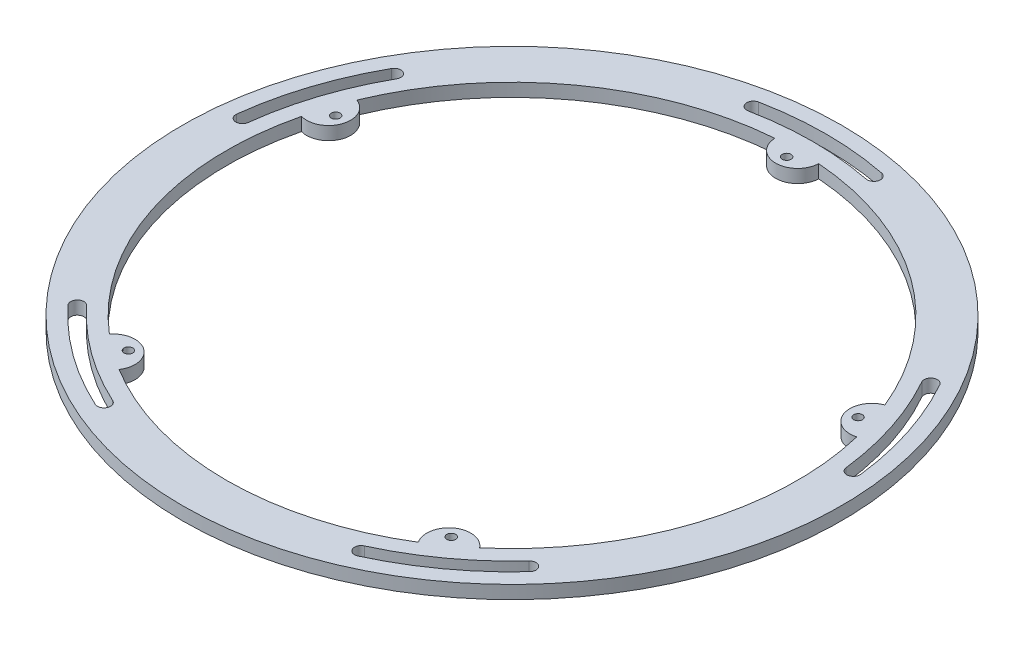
SolidWorks part; units mm, degrees
ref_plane "Plan de face" through (0, 0, 0) normal (0, 0, 1) x (1, 0, 0)
ref_plane "Plan de dessus" through (0, 0, 0) normal (0, 1, 0) x (1, 0, 0)
ref_plane "Plan de droite" through (0, 0, 0) normal (1, 0, 0) x (0, 0, -1)
sketch "Esquisse1" plane through (0, 0, 0) normal (0, 1, 0) x (1, 0, 0)
  line L0 (0, 65) -> (0, 75) construction
  line L1 (0, 65) -> (0, 60) construction
  line L2 (-66.574, 21.6312) -> (0, 0) construction
  circle A0 centre (0, 0) radius 75
  circle A1 centre (0, 0) radius 65 construction
  arc A2 (13.7063, 68.645) -> (-13.7063, 68.645) centre (0, 0) ccw construction
  arc A3 (14, 70.116) -> (-14, 70.116) centre (0, 0) ccw
  arc A4 (13.4126, 67.174) -> (-13.4126, 67.174) centre (0, 0) ccw
  arc A5 (13.4126, 67.174) -> (14, 70.116) centre (13.7063, 68.645) ccw
  arc A6 (-14, 70.116) -> (-13.4126, 67.174) centre (-13.7063, 68.645) ccw
  arc A7 (69.5208, 8.177) -> (61.0498, 34.2479) centre (0, 0) ccw construction
  arc A8 (71.0105, 8.3522) -> (62.358, 34.9818) centre (0, 0) ccw
  arc A9 (68.031, 8.0018) -> (59.7416, 33.5141) centre (0, 0) ccw
  arc A10 (68.031, 8.0018) -> (71.0105, 8.3522) centre (69.5208, 8.177) ccw
  arc A11 (62.358, 34.9818) -> (59.7416, 33.5141) centre (61.0498, 34.2479) ccw
  arc A12 (29.2599, -63.5913) -> (51.4371, -47.4786) centre (0, 0) ccw construction
  arc A13 (29.8869, -64.954) -> (52.5394, -48.496) centre (0, 0) ccw
  arc A14 (28.6329, -62.2287) -> (50.3349, -46.4612) centre (0, 0) ccw
  arc A15 (28.6329, -62.2287) -> (29.8869, -64.954) centre (29.2599, -63.5913) ccw
  arc A16 (52.5394, -48.496) -> (50.3349, -46.4612) centre (51.4371, -47.4786) ccw
  arc A17 (-51.4371, -47.4786) -> (-29.2599, -63.5913) centre (0, 0) ccw construction
  arc A18 (-52.5394, -48.496) -> (-29.8869, -64.954) centre (0, 0) ccw
  arc A19 (-50.3349, -46.4612) -> (-28.6329, -62.2287) centre (0, 0) ccw
  arc A20 (-50.3349, -46.4612) -> (-52.5394, -48.496) centre (-51.4371, -47.4786) ccw
  arc A21 (-29.8869, -64.954) -> (-28.6329, -62.2287) centre (-29.2599, -63.5913) ccw
  arc A22 (-61.0498, 34.2479) -> (-69.5208, 8.177) centre (0, 0) ccw construction
  arc A23 (-62.358, 34.9818) -> (-71.0105, 8.3522) centre (0, 0) ccw
  arc A24 (-59.7416, 33.5141) -> (-68.031, 8.0018) centre (0, 0) ccw
  arc A25 (-59.7416, 33.5141) -> (-62.358, 34.9818) centre (-61.0498, 34.2479) ccw
  arc A26 (-71.0105, 8.3522) -> (-68.031, 8.0018) centre (-69.5208, 8.177) ccw
  arc A27 (4.9963, 64.8077) -> (-4.9963, 64.8077) centre (0, 65) cw
  circle A28 centre (0, 62.5) radius 1
  arc A29 (63.1797, 15.2749) -> (60.0918, 24.7784) centre (61.8187, 20.0861) cw
  circle A30 centre (59.441, 19.3136) radius 1
  arc A31 (34.0509, -55.3673) -> (42.1351, -49.4938) centre (38.206, -52.5861) cw
  circle A32 centre (36.7366, -50.5636) radius 1
  arc A33 (-42.1351, -49.4938) -> (-34.0509, -55.3673) centre (-38.206, -52.5861) cw
  circle A34 centre (-36.7366, -50.5636) radius 1
  arc A35 (-60.0918, 24.7784) -> (-63.1797, 15.2749) centre (-61.8187, 20.0861) cw
  circle A36 centre (-59.441, 19.3136) radius 1
  arc A37 (-60.0918, 24.7784) -> (-4.9963, 64.8077) centre (0, 0) cw
  arc A38 (4.9963, 64.8077) -> (60.0918, 24.7784) centre (0, 0) cw
  arc A39 (63.1797, 15.2749) -> (42.1351, -49.4938) centre (0, 0) cw
  arc A40 (34.0509, -55.3673) -> (-34.0509, -55.3673) centre (0, 0) cw
  arc A41 (-42.1351, -49.4938) -> (-63.1797, 15.2749) centre (0, 0) cw
  point P8 (0, 70)
  point P17 (66.574, 21.6312)
  point P24 (41.145, -56.6312)
  point P31 (-41.145, -56.6312)
  point P38 (-66.574, 21.6312)
  point P43 (0, 0)
  point P69 (0, 0)
  point P81 (0, 0)
  dimension "D1" = 150
  dimension "D2" = 10
  dimension "D3" = 3
  dimension "D6" = 5
  dimension "D7" = 2
  dimension "D9" = 65
  dimension "D4" = 28
  dimension "D5" = 5
  dimension "D8" = 5
  dimension "D10" = 5
extrude "Boss.-Extru.1" add sketch "Esquisse1" along normal blind 3 contours A0 A6 A3 A5 A4 A11 A8 A10 A9 A16 A13 A15 A14 A21 A18 A20 A19 A26 A23 A25 A24 A28 A30 A32 A34 A36 A33 A41 A35 A37 A27 A38 A29 A39 A31 A40
